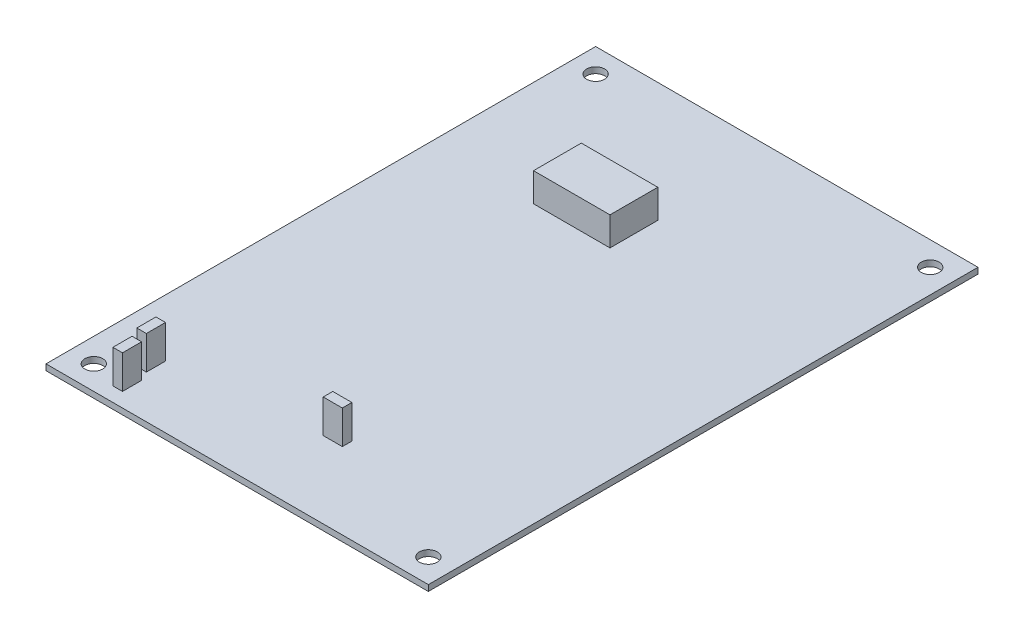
SolidWorks part; units mm, degrees
ref_plane "Front Plane" through (0, 0, 0) normal (0, 0, 1) x (1, 0, 0)
ref_plane "Top Plane" through (0, 0, 0) normal (0, 1, 0) x (1, 0, 0)
ref_plane "Right Plane" through (0, 0, 0) normal (1, 0, 0) x (0, 0, -1)
sketch "Sketch1" plane through (0, 0, 0) normal (0, 1, 0) x (1, 0, 0)
  line L0 (-50.8, 73.025) -> (50.8, -73.025) construction
  line L1 (-50.8, 73.025) -> (50.8, 73.025)
  line L2 (-50.8, 73.025) -> (-50.8, -73.025)
  line L3 (-50.8, -73.025) -> (50.8, -73.025)
  line L4 (50.8, 73.025) -> (50.8, -73.025)
  line L5 (44.45, 66.675) -> (-44.45, -66.675) construction
  line L6 (44.45, 66.675) -> (-44.45, 66.675) construction
  line L7 (44.45, 66.675) -> (44.45, -66.675) construction
  line L8 (44.45, -66.675) -> (-44.45, -66.675) construction
  line L9 (-44.45, 66.675) -> (-44.45, -66.675) construction
  circle A0 centre (-44.45, 66.675) radius 2.3812
  circle A1 centre (44.45, 66.675) radius 2.3812
  circle A2 centre (44.45, -66.675) radius 2.3812
  circle A3 centre (-44.45, -66.675) radius 2.3812
  dimension "D3" = 4.7625
  dimension "D1" = 101.6
  dimension "D2" = 146.05
  dimension "D4" = 133.35
  dimension "D5" = 88.9
extrude "Extrude1" add sketch "Sketch1" along normal blind 1.5875
sketch "Sketch2" plane through (0, 1.5875, 0) normal (0, 1, 0) x (1, 0, 0)
  line L0 (-50.8, -73.025) -> (50.8, -73.025) construction
  line L1 (-22.86, 41.275) -> (-2.54, 41.275)
  line L2 (-22.86, 41.275) -> (-22.86, 28.575)
  line L3 (-22.86, 28.575) -> (-2.54, 28.575)
  line L4 (-2.54, 41.275) -> (-2.54, 28.575)
  line L5 (-50.8, 73.025) -> (-50.8, -73.025) construction
  dimension "D1" = 101.6
  dimension "D2" = 12.7
  dimension "D3" = 27.94
  dimension "D4" = 20.32
extrude "Boss-Extrude1" add sketch "Sketch2" along normal blind 7.62
sketch "Sketch3" plane through (0, 1.5875, 0) normal (0, 1, 0) x (1, 0, 0)
  line L0 (-50.8, -73.025) -> (50.8, -73.025) construction
  line L1 (2.54, -50.165) -> (7.62, -50.165)
  line L2 (2.54, -50.165) -> (2.54, -52.705)
  line L3 (2.54, -52.705) -> (7.62, -52.705)
  line L4 (7.62, -50.165) -> (7.62, -52.705)
  line L5 (50.8, -73.025) -> (50.8, 73.025) construction
  line L6 (-50.8, 73.025) -> (-50.8, -73.025) construction
  line L7 (-38.1, -56.515) -> (-35.56, -56.515)
  line L8 (-38.1, -56.515) -> (-38.1, -61.595)
  line L9 (-38.1, -61.595) -> (-35.56, -61.595)
  line L10 (-35.56, -56.515) -> (-35.56, -61.595)
  line L11 (-36.83, -64.135) -> (-34.29, -64.135)
  line L12 (-36.83, -64.135) -> (-36.83, -69.215)
  line L13 (-36.83, -69.215) -> (-34.29, -69.215)
  line L14 (-34.29, -64.135) -> (-34.29, -69.215)
  dimension "D1" = 5.08
  dimension "D2" = 2.54
  dimension "D3" = 20.32
  dimension "D4" = 43.18
  dimension "D5" = 3.81
  dimension "D6" = 11.43
  dimension "D7" = 12.7
  dimension "D8" = 13.97
extrude "Boss-Extrude2" add sketch "Sketch3" along normal blind 8.89
